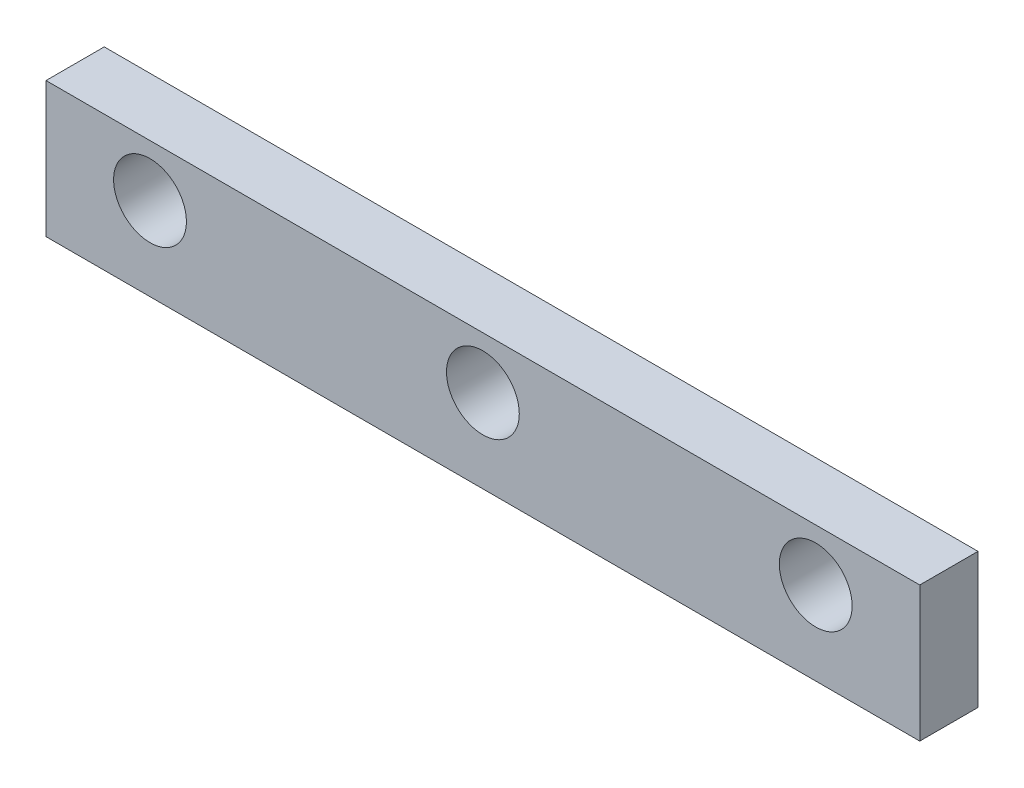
SolidWorks part; units mm, degrees
ref_plane "Plan de face" through (0, 0, 0) normal (0, 0, 1) x (1, 0, 0)
ref_plane "Plan de dessus" through (0, 0, 0) normal (0, 1, 0) x (1, 0, 0)
ref_plane "Plan de droite" through (0, 0, 0) normal (1, 0, 0) x (0, 0, -1)
sketch "Esquisse1" plane through (0, 0, 0) normal (0, 0, 1) x (1, 0, 0)
  line L0 (0, 6.5) -> (0, 0) construction
  line L1 (-21, 0) -> (21, 0)
  line L2 (-21, 0) -> (-21, 6.5)
  line L3 (-21, 6.5) -> (21, 6.5)
  line L4 (21, 0) -> (21, 6.5)
  line L5 (-21, 4) -> (21, 4) construction
  line L6 (-21, 8) -> (21, 8) construction
  circle A0 centre (-16, 4) radius 1.75
  circle A1 centre (16, 4) radius 1.75
  circle A2 centre (0, 4) radius 1.75
  dimension "D1" = 3.5
  dimension "D2" = 32
  dimension "D3" = 5
  dimension "D4" = 1.5
  dimension "D5" = 8
  dimension "D6" = 4
extrude "Boss.-Extru.1" add sketch "Esquisse1" along normal blind 2.8
